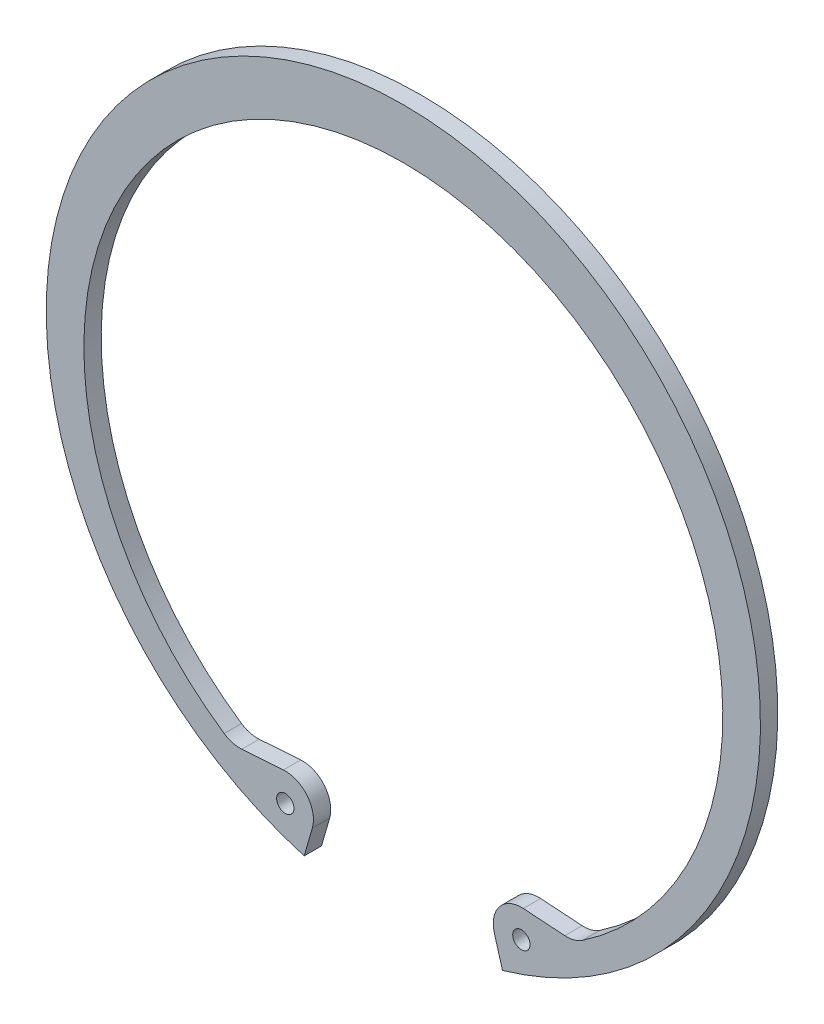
SolidWorks part; units mm, degrees
ref_plane "Face" through (0, 0, 0) normal (0, 0, 1) x (1, 0, 0)
ref_plane "Dessus" through (0, 0, 0) normal (0, 1, 0) x (1, 0, 0)
ref_plane "Droite" through (0, 0, 0) normal (1, 0, 0) x (0, 0, -1)
sketch "Esquisse1" plane through (0, 0, 0) normal (0, 0, 1) x (1, 0, 0)
  line L0 (0, 70.9) -> (0, 82.5) construction
  line L1 (21.0256, -72.7439) -> (22.9078, -79.2558)
  line L2 (24.9377, -64.8719) -> (29.6023, -77.0062) construction
  line L3 (37.3047, -65.1045) -> (27.7097, -64.4539)
  line L4 (-37.3047, -65.1045) -> (-27.7097, -64.4539)
  line L5 (-21.0256, -72.7439) -> (-22.9078, -79.2558)
  line L6 (26.5823, -73.0343) -> (28.9007, -79.404) construction
  line L7 (-26.5823, -73.0343) -> (-28.9007, -79.404) construction
  arc A0 (22.9078, -79.2558) -> (-22.9078, -79.2558) centre (0, 0) ccw
  arc A1 (41.3899, -64.0009) -> (-41.3899, -64.0009) centre (0, -2.9) ccw
  arc A2 (27.7097, -64.4539) -> (21.0256, -72.7439) centre (27.27, -70.939) ccw
  arc A3 (37.3047, -65.1045) -> (41.3899, -64.0009) centre (37.7444, -58.6194) ccw
  circle A4 centre (27.27, -70.939) radius 2
  arc A5 (-37.3047, -65.1045) -> (-41.3899, -64.0009) centre (-37.7444, -58.6194) cw
  circle A6 centre (-27.27, -70.939) radius 2
  arc A7 (-27.7097, -64.4539) -> (-21.0256, -72.7439) centre (-27.27, -70.939) cw
  arc A8 (28.9007, -79.404) -> (-28.9007, -79.404) centre (0, 0) ccw construction
  circle A9 centre (0, 0) radius 80 construction
  dimension "dgorge" = 165
  dimension "D3" = 2.9
  dimension "dtrou" = 4
  dimension "dext" = 169
  dimension "dn" = 160
  dimension "b" = 11.6
  dimension "a" = 13
  dimension "D5" = 70
  dimension "D7" = 32.242
  dimension "D9" = 40
extrude "Base-Extrusion" add sketch "Esquisse1" along normal blind 4
equation "\"D3@Esquisse1\" = \"b@Esquisse1\"/4"
equation "\"D7@Esquisse1\" = 360-(360-\"D9@Esquisse1\")*\"dext@Esquisse1\"/\"dgorge@Esquisse1\""
